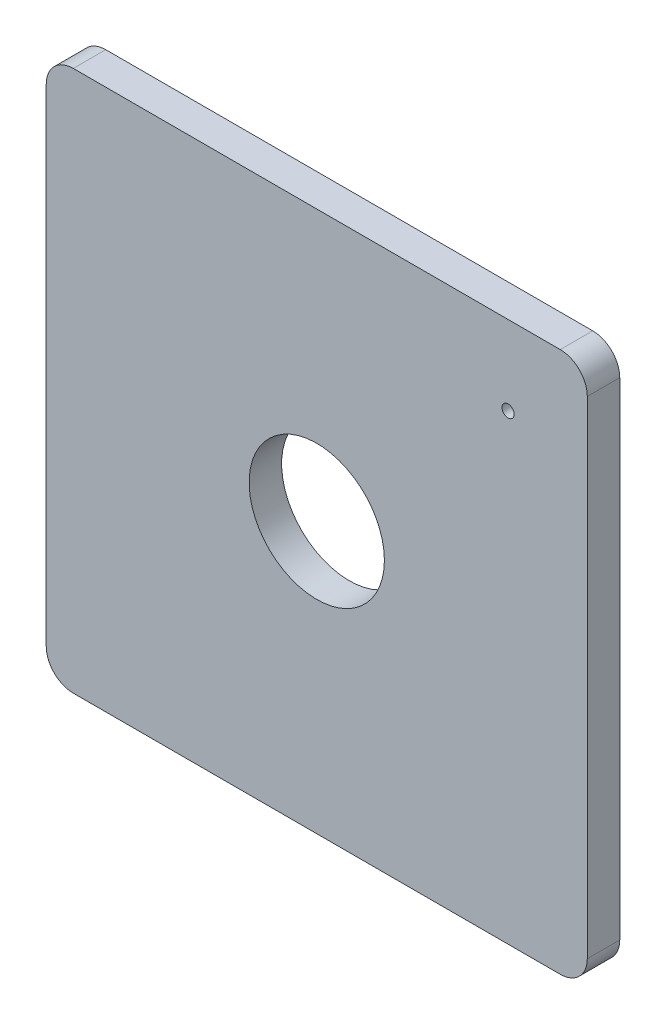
SolidWorks part; units mm, degrees
ref_plane "Plan de face" through (0, 0, 0) normal (0, 0, 1) x (1, 0, 0)
ref_plane "Plan de dessus" through (0, 0, 0) normal (0, 1, 0) x (1, 0, 0)
ref_plane "Plan de droite" through (0, 0, 0) normal (1, 0, 0) x (0, 0, -1)
sketch "Esquisse1" plane through (0, 0, 0) normal (0, 0, 1) x (1, 0, 0)
  line L0 (0, 0) -> (200, -200) construction
  line L1 (0, 0) -> (200, 0)
  line L2 (0, 0) -> (0, -200)
  line L3 (0, -200) -> (200, -200)
  line L4 (200, 0) -> (200, -200)
  circle A0 centre (100, -100) radius 25
  dimension "D3" = 50
  dimension "D1" = 200
  dimension "D2" = 200
extrude "Boss.-Extru.1" add sketch "Esquisse1" along normal blind 12
sketch "Esquisse2" plane through (0, 0, 12) normal (0, 0, 1) x (1, 0, 0)
  line L0 (100, -100) -> (200, 0) construction
  circle A0 centre (170.7107, -29.2893) radius 2.25
  dimension "D1" = 4.5
  dimension "D2" = 100
extrude "Enlèv. mat.-Extru.1" cut sketch "Esquisse2" against normal through all
chamfer "Chanfrein1" distance 4 angle 45 1 edges at (172.9607, -29.2893, 0)
fillet "Congé2" radius 10 4 edges at (0, -200, 6) (200, -200, 6) (200, 0, 6) (0, 0, 6)
